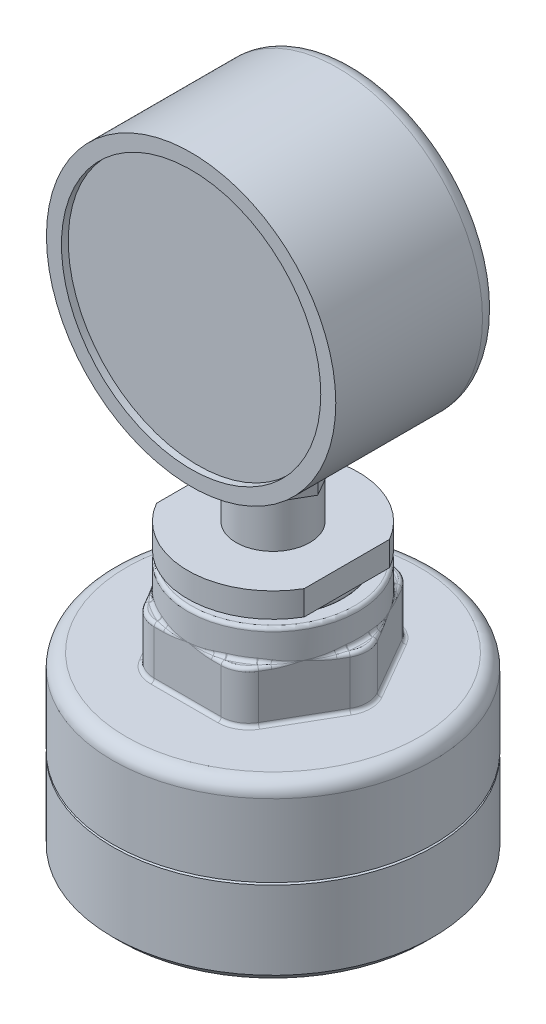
SolidWorks part; units mm, degrees
ref_plane "Front Plane" through (0, 0, 0) normal (0, 0, 1) x (1, 0, 0)
ref_plane "Top Plane" through (0, 0, 0) normal (0, 1, 0) x (1, 0, 0)
ref_plane "Right Plane" through (0, 0, 0) normal (1, 0, 0) x (0, 0, -1)
sketch "Sketch1" plane through (0, 0, 0) normal (0, 1, 0) x (1, 0, 0)
  circle A0 centre (0, 0) radius 29.845
  dimension "D1" = 59.69
extrude "Boss-Extrude1" add sketch "Sketch1" along normal blind 32.512
chamfer "Chamfer1" distance 1.524 angle 45 1 edges at (0, 0, 29.845)
sketch "Sketch2" plane through (0, 0, 0) normal (0, 1, 0) x (1, 0, 0)
  line L0 (0, 0) -> (-29.845, 0) construction
  circle A0 centre (0, 0) radius 29.845 construction
  circle A1 centre (0, 0) radius 22.4155 construction
  circle A2 centre (-22.4155, 0) radius 3.9624
  dimension "D1" = 44.831
  dimension "D2" = 7.9248
extrude "Cut-Extrude1" cut sketch "Sketch2" along normal blind 7.9248
pattern_circular "CirPattern1" count 2 over 360 about axis through (0, 0, 0) along (0, 1, 0) of "Cut-Extrude1"
ref_plane "Plane1" through (0, 32.512, 0) normal (0, 1, 0) x (1, 0, 0)
sketch "Sketch3" plane through (0, 32.512, 0) normal (0, 1, 0) x (1, 0, 0)
  line L1 (-18.3309, 0) -> (-9.1654, -15.875)
  line L2 (-9.1654, -15.875) -> (9.1654, -15.875)
  line L3 (9.1654, -15.875) -> (18.3309, 0)
  line L4 (18.3309, 0) -> (9.1654, 15.875)
  line L5 (9.1654, 15.875) -> (-9.1654, 15.875)
  line L6 (-9.1654, 15.875) -> (-18.3309, 0)
  circle A0 centre (0, 0) radius 15.875 construction
extrude "Boss-Extrude2" add sketch "Sketch3" along normal blind 9.525
fillet "Fillet1" radius 5.08 6 edges at (9.1654, 37.2745, 15.875) (18.3309, 37.2745, 0) (9.1654, 37.2745, -15.875) (-9.1654, 37.2745, -15.875) (-18.3309, 37.2745, 0) (-9.1654, 37.2745, 15.875)
fillet "Fillet2" radius 2.54 1 edges at (0, 32.512, 29.845)
sketch "Sketch4" plane through (0, 32.512, 0) normal (0, 1, 0) x (1, 0, 0)
  circle A0 centre (0, 0) radius 15.875
extrude "Boss-Extrude3" add sketch "Sketch4" along normal blind 15.113
fillet "Fillet5" radius 0.635 1 edges at (0, 47.625, 15.875)
fillet "Fillet6" radius 0.635 12 edges at (13.7482, 32.512, 7.9375) (8.7725, 32.512, 15.1944) (0, 32.512, 15.875) (-8.7725, 32.512, 15.1944) (-13.7482, 32.512, 7.9375) (-17.545, 32.512, 0) (-13.7482, 32.512, -7.9375) (-8.7725, 32.512, -15.1944) (0, 32.512, -15.875) (8.7725, 32.512, -15.1944) (17.545, 32.512, 0) (13.7482, 32.512, -7.9375)
fillet "Fillet7" radius 0.635 18 edges at (-12.19, 42.037, 10.6363) (-15.3063, 42.037, 5.2388) (-17.545, 42.037, 0) (-15.3063, 42.037, -5.2388) (-12.19, 42.037, -10.6363) (-8.7725, 42.037, -15.1944) (-3.1162, 42.037, -15.875) (3.1162, 42.037, -15.875) (8.7725, 42.037, -15.1944) (12.19, 42.037, -10.6363) (15.3063, 42.037, -5.2388) (17.545, 42.037, 0) (15.3063, 42.037, 5.2387) (12.19, 42.037, 10.6363) (8.7725, 42.037, 15.1944) (3.1162, 42.037, 15.875) (-3.1162, 42.037, 15.875) (-8.7725, 42.037, 15.1944)
fillet "Fillet8" radius 0.635 18 edges at (-2.2451, 42.037, 15.7154) (2.2451, 42.037, 15.7154) (7.9375, 42.037, 13.7482) (12.4874, 42.037, 9.802) (14.7325, 42.037, 5.9134) (15.875, 42.037, 0) (14.7325, 42.037, -5.9134) (12.4874, 42.037, -9.802) (7.9375, 42.037, -13.7482) (2.2451, 42.037, -15.7154) (-2.2451, 42.037, -15.7154) (-7.9375, 42.037, -13.7482) (-12.4874, 42.037, -9.802) (-14.7325, 42.037, -5.9134) (-15.875, 42.037, 0) (-14.7325, 42.037, 5.9134) (-12.4874, 42.037, 9.802) (-7.9375, 42.037, 13.7482)
ref_plane "Plane2" through (0, 53.594, 0) normal (0, 1, 0) x (1, 0, 0)
sketch "Sketch9" plane through (0, 53.594, 0) normal (0, 1, 0) x (1, 0, 0)
  line L2 (-13.7482, 7.9375) -> (-13.7482, -7.9375)
  line L3 (13.7482, -7.9375) -> (13.7482, 7.9375)
  arc A1 (-13.7482, 7.9375) -> (13.7482, 7.9375) centre (0, 0) cw
  arc A2 (-13.7482, -7.9375) -> (13.7482, -7.9375) centre (0, 0) ccw
extrude "Boss-Extrude4" add sketch "Sketch9" against normal blind 4.572 separate body
sketch "Sketch10" plane through (0, 53.594, 0) normal (0, 1, 0) x (1, 0, 0)
  circle A0 centre (0, 0) radius 11.1125
  dimension "D1" = 22.225
extrude "Boss-Extrude5" add sketch "Sketch10" against normal blind 9.525
sketch "Sketch11" plane through (0, 0, 0) normal (0, 1, 0) x (1, 0, 0)
  circle A0 centre (0, 0) radius 6.858
  dimension "D1" = 13.716
extrude "Boss-Extrude6" add sketch "Sketch11" along normal blind 93.726
sketch "Sketch12" plane through (0, 0, 0) normal (0, 0, 1) x (1, 0, 0)
  line L0 (6.858, 93.726) -> (-6.858, 93.726) construction
  circle A0 centre (0, 93.726) radius 26.924
  dimension "D1" = 53.848
extrude "Boss-Extrude7" add sketch "Sketch12" along normal mid plane 30.48
fillet "Fillet9" radius 3.175 1 edges at (26.924, 93.726, -15.24)
ref_plane "Plane3" through (0, 0, 15.24) normal (0, 0, 1) x (1, 0, 0)
sketch "Sketch13" plane through (0, 0, 15.24) normal (0, 0, 1) x (1, 0, 0)
  circle A0 centre (0, 93.726) radius 24.13
  dimension "D1" = 48.26
extrude "Cut-Extrude2" cut sketch "Sketch13" against normal blind 1.27
ref_plane "Plane4" through (0, 93.726, 0) normal (0, 1, 0) x (1, 0, 0)
sketch "Sketch14" plane through (0, 93.726, 0) normal (0, 1, 0) x (1, 0, 0)
  line L1 (-8.3348, 0) -> (-4.1674, -7.2181)
  line L2 (-4.1674, -7.2181) -> (4.1674, -7.2181)
  line L3 (4.1674, -7.2181) -> (8.3348, 0)
  line L4 (8.3348, 0) -> (4.1674, 7.2181)
  line L5 (4.1674, 7.2181) -> (-4.1674, 7.2181)
  line L6 (-4.1674, 7.2181) -> (-8.3348, 0)
  circle A0 centre (0, 0) radius 7.2181 construction
extrude "Boss-Extrude8" add sketch "Sketch14" against normal blind 31.75
hole_wizard "1/4 NPT Tapped Hole1" positions "Sketch16" profile "Sketch15" size "1/4" standard "ANSI Inch"
sketch "Sketch16" plane through (0, 0, 0) normal (0, 1, 0) x (1, 0, 0)
  point P0 (0, 0)
sketch "Sketch15" plane through (0, 0, 0) normal (1, 0, 0) x (0, 0, -1)
  line L0 (0, 0) -> (0, 20.3603)
  line L1 (5.5626, 17.018) -> (0, 20.3603)
  line L2 (-5.5626, 17.018) -> (0, 20.3603) construction
  line L3 (5.5626, 17.018) -> (5.5626, 9.906)
  line L4 (5.5626, 9.906) -> (5.9437, 9.906)
  line L5 (5.9437, 9.906) -> (6.2403, 0)
  line L6 (-5.9437, 9.906) -> (-6.2403, 0) construction
  line L7 (6.2403, 0) -> (0, 0)
  line L8 (0, -6.35) -> (0, 107.95) construction
  line L11 (-5.5626, 9.906) -> (-5.9437, 9.906) construction
  dimension "Tap Drill Dia." = 11.1252
  dimension "Tap Drill Depth" = 17.018
  dimension "Thread Dia." = 12.4806
  dimension "Thread Angle" = 3.43
  dimension "Thread Depth" = 9.906
  dimension "Drill Angle" = 118
sketch "Sketch17" plane through (0, 0, 0) normal (0, 0, 1) x (1, 0, 0)
  line L0 (0, 0) -> (0, 93.726) construction
  line L1 (-12.446, 47.625) -> (-12.446, 49.022) construction
  line L2 (15.24, 47.625) -> (-15.24, 47.625) construction
  line L3 (-13.7482, 49.022) -> (13.7482, 49.022) construction
  circle A0 centre (-12.446, 48.3235) radius 0.889
  dimension "D2" = 1.778
  dimension "D1" = 12.446
revolve "Revolve1" add sketch "Sketch17" angle 360 about L0
sketch "Sketch18" plane through (0, 0, 0) normal (0, 0, 1) x (1, 0, 0)
  line L0 (0, 0) -> (0, 32.512) construction
  line L1 (27.305, 32.512) -> (-27.305, 32.512) construction
  line L2 (-27.3528, 16.256) -> (-32.6998, 16.256) construction
  line L3 (-29.337, 16.256) -> (-30.9701, 15.5796)
  line L4 (-30.9701, 15.5796) -> (-30.9701, 16.9324)
  line L5 (-30.9701, 16.9324) -> (-29.337, 16.256)
  line L6 (-29.845, 29.972) -> (-29.845, 1.524) construction
  line L7 (-28.321, 0) -> (28.321, 0) construction
  dimension "D1" = 45
  dimension "D2" = 22.5
  dimension "D3" = 0.508
  dimension "D4" = 16.256
revolve "Cut-Revolve1" cut sketch "Sketch18" angle 360 about L0
